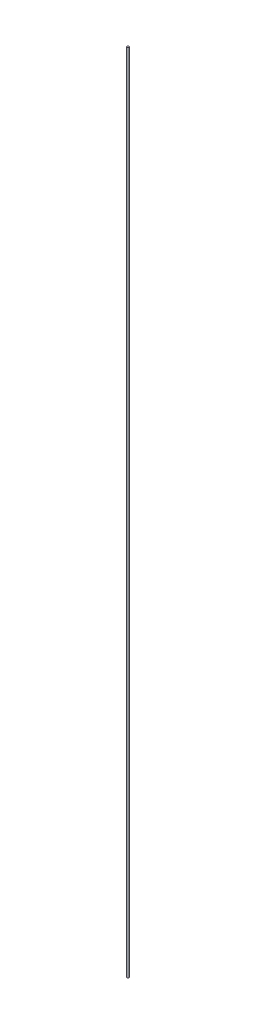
SolidWorks part; units mm, degrees
ref_plane "Plan de face" through (0, 0, 0) normal (0, 0, 1) x (1, 0, 0)
ref_plane "Plan de dessus" through (0, 0, 0) normal (0, 1, 0) x (1, 0, 0)
ref_plane "Plan de droite" through (0, 0, 0) normal (1, 0, 0) x (0, 0, -1)
sketch "Esquisse1" plane through (0, 0, 0) normal (0, 1, 0) x (1, 0, 0)
  circle A0 centre (0, 0) radius 1.5
  dimension "D1" = 3
extrude "Extrusion1" add sketch "Esquisse1" along normal blind 1180
